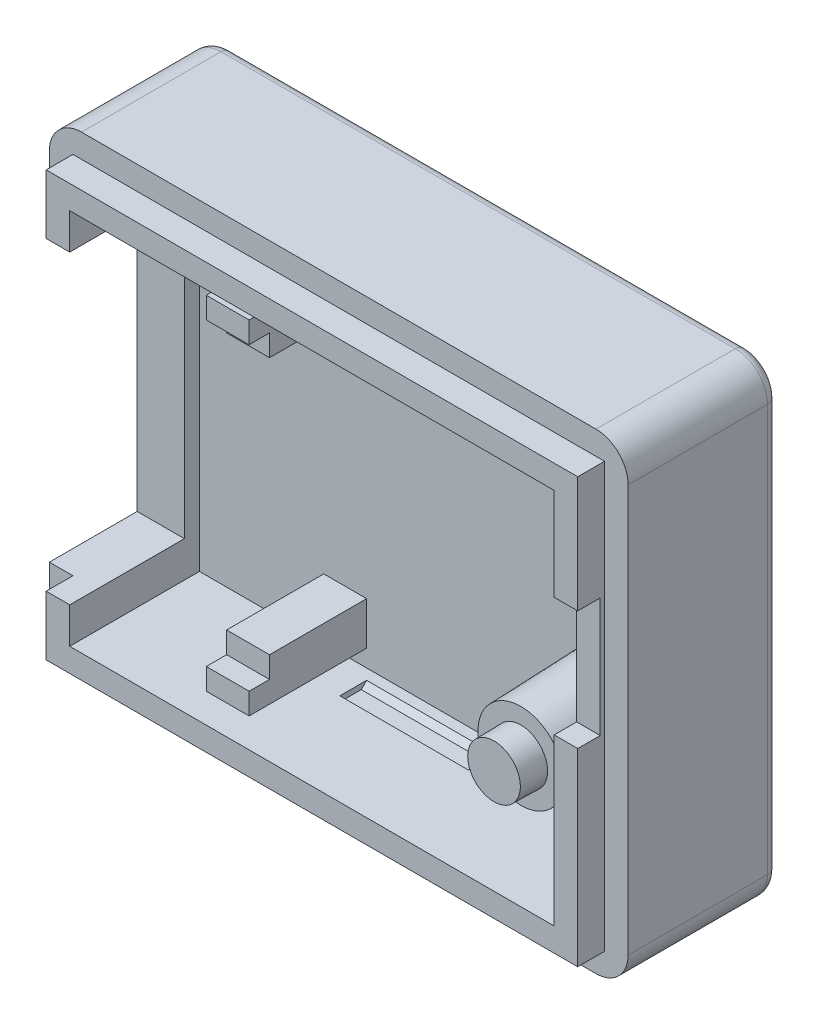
SolidWorks part; units mm, degrees
ref_plane "Front Plane" through (0, 0, 0) normal (0, 0, 1) x (1, 0, 0)
ref_plane "Top Plane" through (0, 0, 0) normal (0, 1, 0) x (1, 0, 0)
ref_plane "Right Plane" through (0, 0, 0) normal (1, 0, 0) x (0, 0, -1)
body saved out of another part "Stock-connector enclosure-1"
